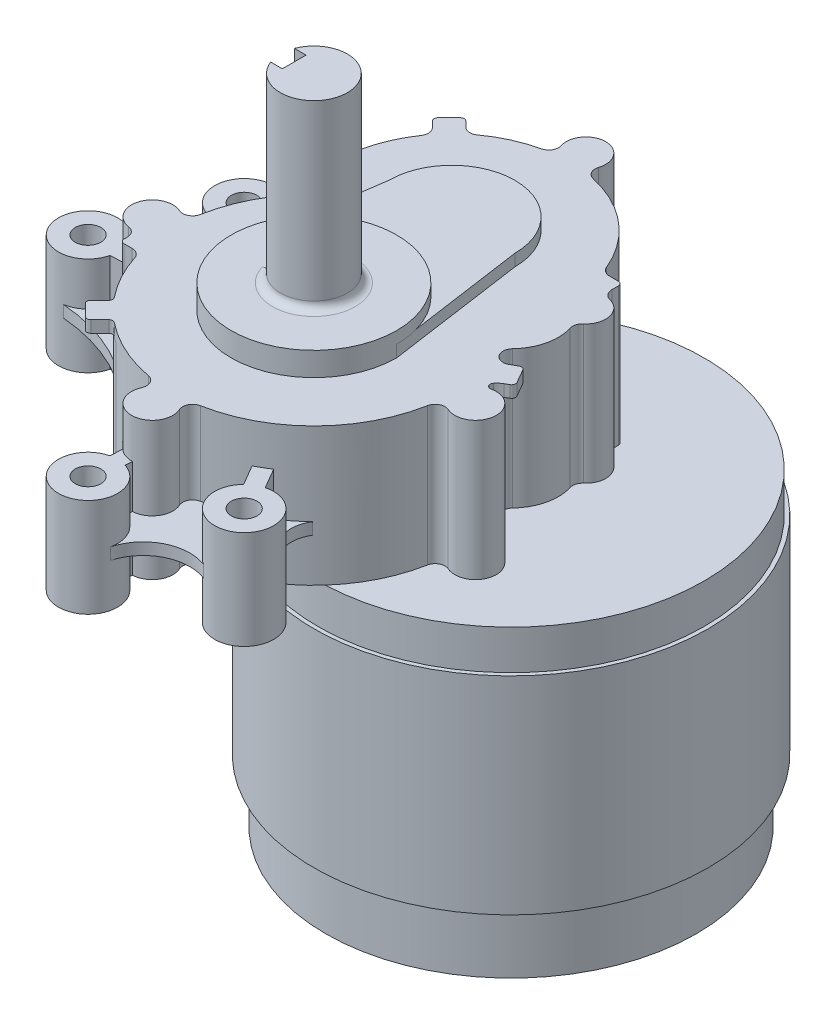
SolidWorks part; units mm, degrees
other "Markup1"
sketch "Sketch2" plane through (-62.6543, 46, -75) normal (0, 1, 0) x (1, 0, 0)
sketch "Sketch3" plane through (-62.6543, 46, -75) normal (0, 1, 0) x (1, 0, 0)
ref_plane "Front Plane" through (0, 0, 0) normal (0, 0, 1) x (1, 0, 0)
ref_plane "Top Plane" through (0, 0, 0) normal (0, 1, 0) x (1, 0, 0)
ref_plane "Right Plane" through (0, 0, 0) normal (1, 0, 0) x (0, 0, -1)
imported_body "motor dc my1016z 250w 24v.stp<1>"
sketch "Sketch1" plane through (0, -27, 0) normal (0, 1, 0) x (1, 0, 0)
  circle A0 centre (-55.1543, -2.1213) radius 3.25
extrude "Cut-Extrude1" cut sketch "Sketch1" against normal through all
